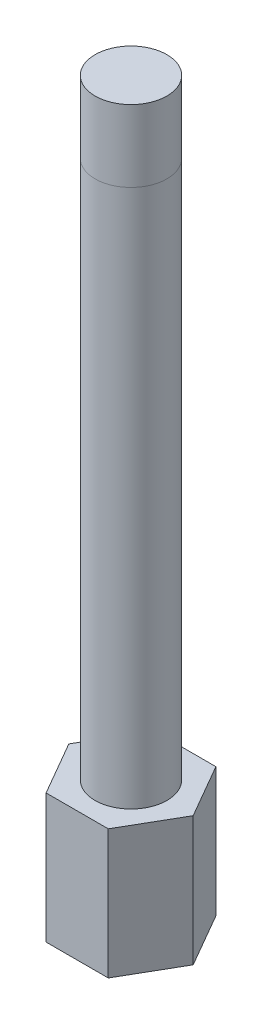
SolidWorks part; units mm, degrees
ref_plane "Front Plane" through (0, 0, 0) normal (0, 0, 1) x (1, 0, 0)
ref_plane "Top Plane" through (0, 0, 0) normal (0, 1, 0) x (1, 0, 0)
ref_plane "Right Plane" through (0, 0, 0) normal (1, 0, 0) x (0, 0, -1)
sketch "Sketch1" plane through (0, 0, 0) normal (0, 1, 0) x (1, 0, 0)
  line L1 (-8.6603, 0) -> (-4.3301, -7.5)
  line L2 (-4.3301, -7.5) -> (4.3301, -7.5)
  line L3 (4.3301, -7.5) -> (8.6603, 0)
  line L4 (8.6603, 0) -> (4.3301, 7.5)
  line L5 (4.3301, 7.5) -> (-4.3301, 7.5)
  line L6 (-4.3301, 7.5) -> (-8.6603, 0)
  circle A0 centre (0, 0) radius 7.5 construction
  dimension "D1" = 15
extrude "Boss-Extrude1" add sketch "Sketch1" along normal blind 18
sketch "Sketch2" plane through (0, 18, 0) normal (0, 1, 0) x (1, 0, 0)
  circle A0 centre (0, 0) radius 5
  dimension "D1" = 10
extrude "Boss-Extrude2" add sketch "Sketch2" along normal blind 85
sketch "Sketch3" plane through (0, 0, 0) normal (0, 0, 1) x (1, 0, 0)
  line L0 (-5, 93) -> (5, 93)
  line L1 (-5, 103) -> (-5, 18) construction
  line L2 (5, 18) -> (5, 103) construction
  line L3 (5, 103) -> (-5, 103) construction
  dimension "D1" = 10
